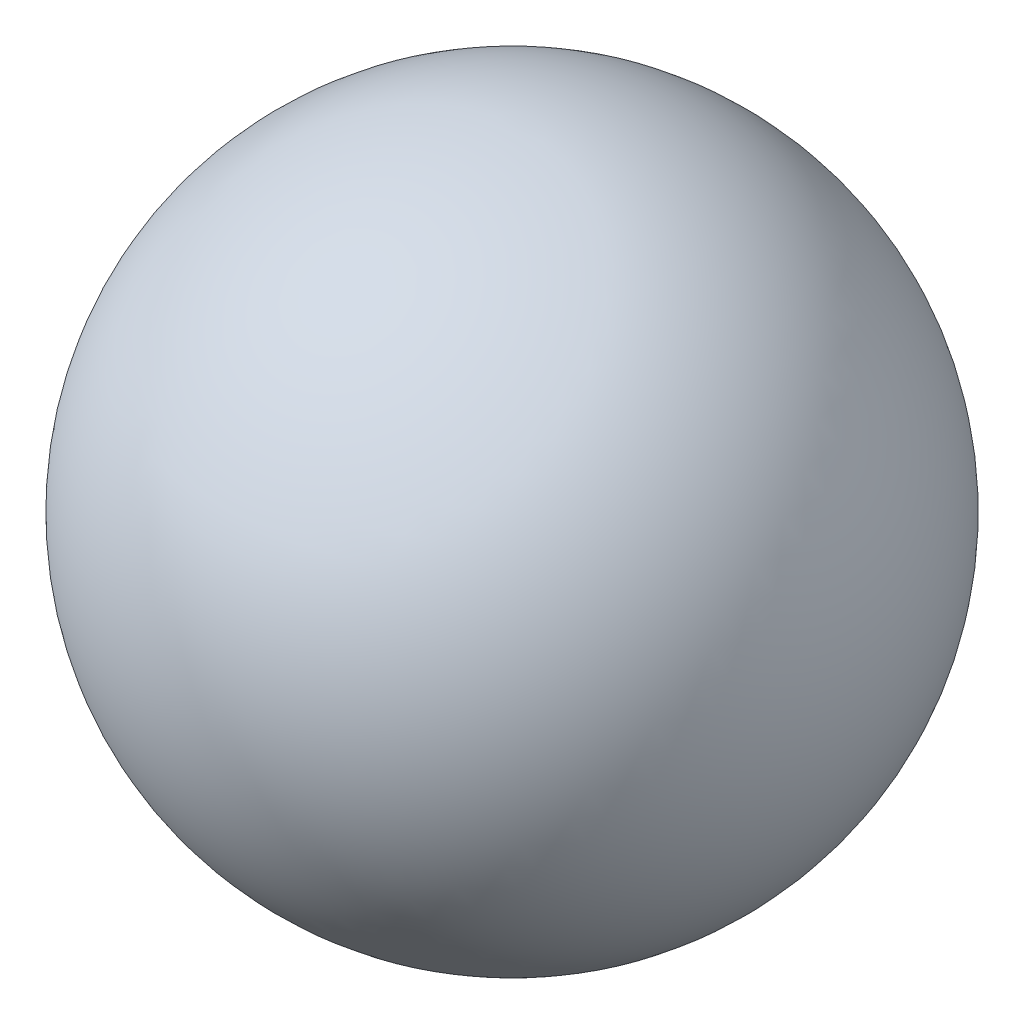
SolidWorks part; units mm, degrees
ref_plane "Front" through (0, 0, 0) normal (0, 0, 1) x (1, 0, 0)
ref_plane "Top" through (0, 0, 0) normal (0, 1, 0) x (1, 0, 0)
ref_plane "Right" through (0, 0, 0) normal (1, 0, 0) x (0, 0, -1)
sketch "Sketch1" plane through (0, 0, 0) normal (0, 0, 1) x (1, 0, 0)
  line L0 (0, 0.35) -> (0, -0.35)
  arc A0 (0, 0.35) -> (0, -0.35) centre (0, 0) ccw
  dimension "D1" = 0.7
revolve "Revolve1" add sketch "Sketch1" angle 360 about L0
